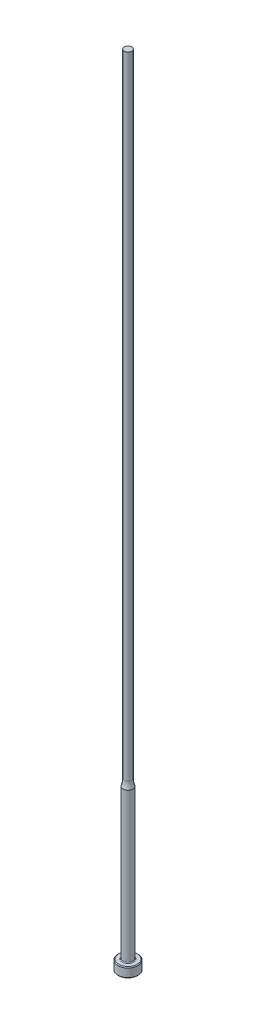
SolidWorks part; units mm, degrees
ref_plane "Front Plane" through (0, 0, 0) normal (0, 0, 1) x (1, 0, 0)
ref_plane "Top Plane" through (0, 0, 0) normal (0, 1, 0) x (1, 0, 0)
ref_plane "Right Plane" through (0, 0, 0) normal (1, 0, 0) x (0, 0, -1)
sketch "Sketch1" plane through (0, 0, 0) normal (0, 0, 1) x (1, 0, 0)
  line L0 (0, 259.9588) -> (0, -15.1925) construction
  line L1 (0, 0) -> (-3.175, 0)
  line L2 (-3.175, 0) -> (-3.175, 3.175)
  line L3 (-3.175, 3.175) -> (-1.5875, 3.175)
  line L4 (-1.19, 53.0114) -> (-1.19, 254)
  line L5 (-1.19, 254) -> (0, 254)
  line L6 (0, 254) -> (0, 0)
  line L7 (-1.5875, 3.175) -> (-1.5875, 50.8)
  arc A0 (-1.5875, 50.8) -> (-1.19, 53.0114) centre (-7.54, 53.0114) ccw
  point P13 (-1.5875, 0)
  dimension "D1" = 6.35
  dimension "L" = 254
  dimension "D2" = 3.175
  dimension "H" = 6.35
  dimension "T" = 3.175
  dimension "D" = 2.38
  dimension "S" = 50.8
revolve "Revolve1" add sketch "Sketch1" angle 360 about L0
chamfer "Chamfer1" distance 0.254 angle 45 2 edges at (0, 3.175, 3.175) (0, 0, 3.175)
fillet "Fillet1" radius 0.254 1 edges at (0, 3.175, 1.5875)
